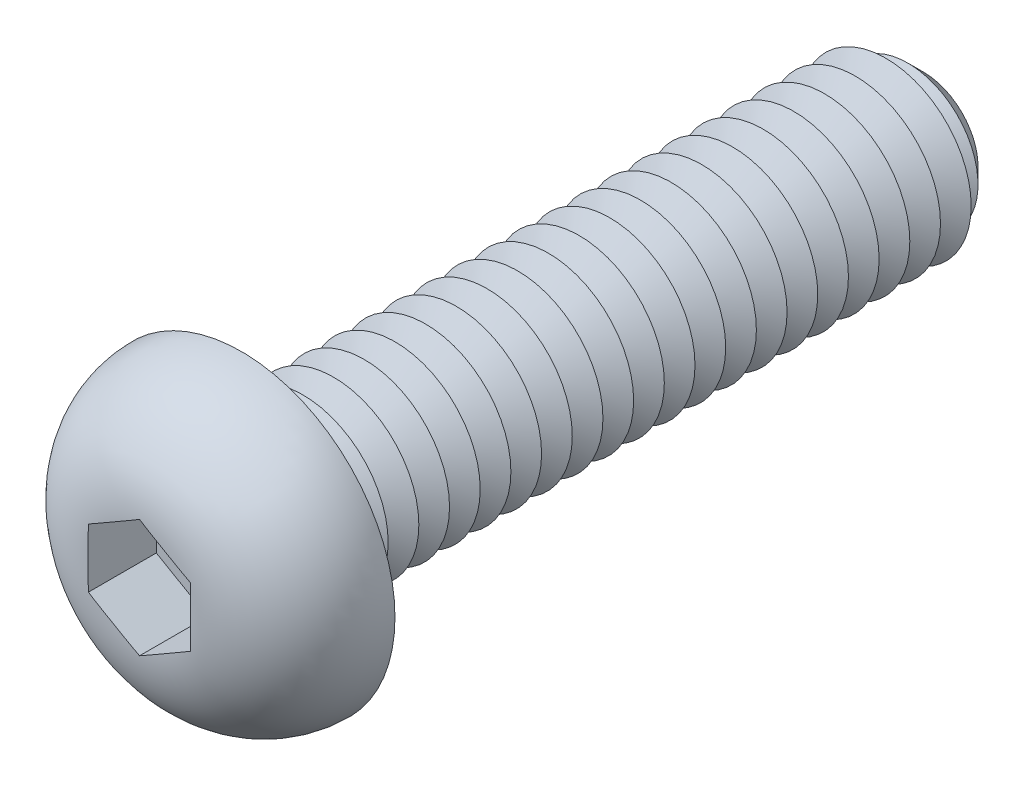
SolidWorks part; units mm, degrees
ref_plane "Front Plane" through (0, 0, 0) normal (0, 0, 1) x (1, 0, 0)
ref_plane "Top Plane" through (0, 0, 0) normal (0, 1, 0) x (1, 0, 0)
ref_plane "Right Plane" through (0, 0, 0) normal (1, 0, 0) x (0, 0, -1)
sketch "Sketch1" plane through (0, 0, 0) normal (1, 0, 0) x (0, 0, -1)
  line L0 (-47.9342, 0) -> (60.3146, 0) construction
sketch "Sketch2" plane through (0, 0, 0) normal (1, 0, 0) x (0, 0, -1)
  line L0 (0, 0) -> (-1.5, 0)
  line L1 (-47.9342, 0) -> (60.3146, 0) construction
  line L2 (-1.5, 0) -> (-1.5, 0.75)
  line L3 (0, 2.25) -> (0, 0)
  arc A0 (-1.5, 0.75) -> (0, 2.25) centre (0, 0.75) cw
  dimension "D1" = 1.5
  dimension "D2" = 1.5
  dimension "D3" = 2.25
revolve "Revolve1" add sketch "Sketch2" angle 360 about L0
sketch "Sketch3" plane through (0, 0, 1.5) normal (0, 0, 1) x (1, 0, 0)
  line L1 (0, 0.866) -> (-0.75, 0.433)
  line L2 (-0.75, 0.433) -> (-0.75, -0.433)
  line L3 (-0.75, -0.433) -> (0, -0.866)
  line L4 (0, -0.866) -> (0.75, -0.433)
  line L5 (0.75, -0.433) -> (0.75, 0.433)
  line L6 (0.75, 0.433) -> (0, 0.866)
  circle A0 centre (0, 0) radius 0.75 construction
  dimension "D1" = 1.5
extrude "Cut-Extrude1" cut sketch "Sketch3" against normal blind 1
sketch "Sketch4" plane through (0, 0, 0) normal (0, 0, -1) x (-1, 0, 0)
  circle A0 centre (0, 0) radius 1.25
  dimension "D1" = 2.5
extrude "Boss-Extrude1" add sketch "Sketch4" along normal blind 10
chamfer "Chamfer1" distance 0.45 angle 45 1 edges at (-1.25, 0, -10)
sketch "Sketch5" plane through (0, 0, 0) normal (1, 0, 0) x (0, 0, -1)
  line L0 (0.45, 1.25) -> (0.9, 1.25)
  line L1 (9.55, 1.25) -> (0, 1.25) construction
  line L2 (0.9, 1.25) -> (0.675, 0.8603)
  line L3 (0.675, 0.8603) -> (0.45, 1.25)
  line L4 (0, -2.25) -> (0, 2.25) construction
  line L5 (9.55, 1.25) -> (0, 1.25) construction
  dimension "D1" = 0.45
  dimension "D2" = 0.45
revolve "Cut-Revolve1" cut sketch "Sketch5" angle 360 about L0
pattern_linear "LPattern1" count 21 spacing 0.45 along (0, 0, -1) of "Cut-Revolve1"
fillet "Fillet2" radius 0.225 1 edges at (1.25, 0, 0)
sketch "Sketch6" plane through (0, 0, 0.5) normal (0, 0, 1) x (1, 0, 0)
  circle A0 centre (0, 0) radius 0.45
  dimension "D1" = 0.9
extrude "Cut-Extrude2" cut sketch "Sketch6" against normal up to surface (10.5 mm away)
